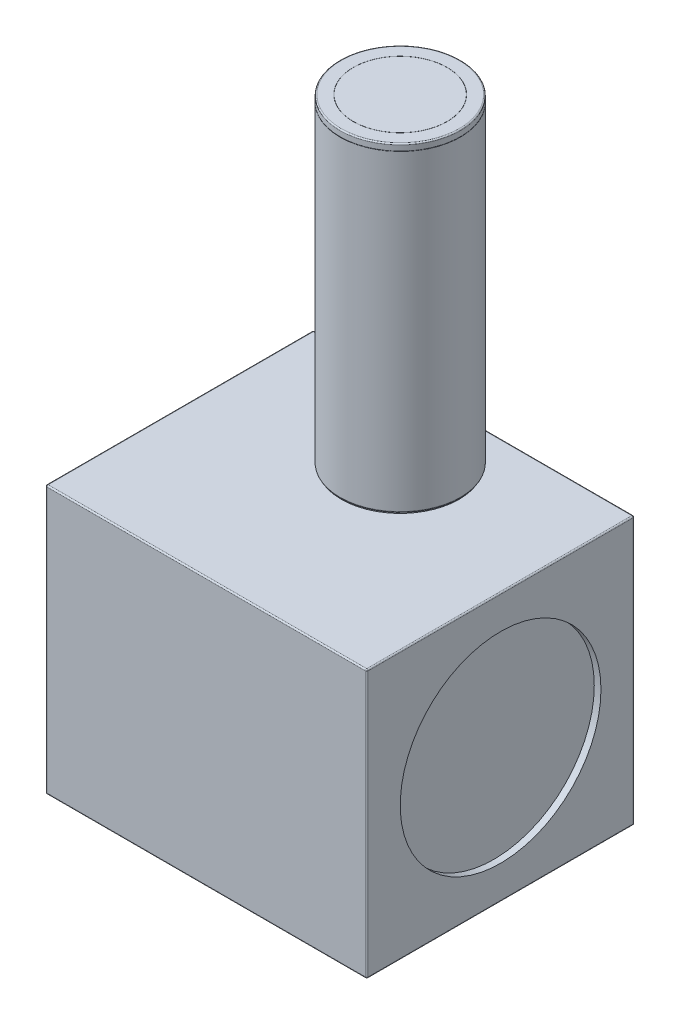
SolidWorks part; units mm, degrees
ref_plane "Front Plane" through (0, 0, 0) normal (0, 0, 1) x (1, 0, 0)
ref_plane "Top Plane" through (0, 0, 0) normal (0, 1, 0) x (1, 0, 0)
ref_plane "Right Plane" through (0, 0, 0) normal (1, 0, 0) x (0, 0, -1)
sketch "Sketch1" plane through (0, 0, 0) normal (0, 0, 1) x (1, 0, 0)
  line L1 (-12, 10) -> (12, 10)
  line L2 (-12, 10) -> (-12, -10)
  line L3 (-12, -10) -> (12, -10)
  line L4 (12, 10) -> (12, -10)
  dimension "D1" = 24
  dimension "D2" = 12
  dimension "D3" = 10
  dimension "D4" = 20
extrude "Boss-Extrude1" add sketch "Sketch1" along normal blind 20
sketch "Sketch2" plane through (12, 0, 0) normal (1, 0, 0) x (0, 0, -1)
  line L0 (-10, 10) -> (-10, -10) construction
  line L1 (-20, 10) -> (0, 10) construction
  line L2 (-20, -10) -> (0, -10) construction
  line L3 (0, 0) -> (-20, 0) construction
  line L4 (-20, -10) -> (-20, 10) construction
  circle A0 centre (-10, 0) radius 7.5
  dimension "D1" = 15
extrude "Cut-Extrude1" cut sketch "Sketch2" against normal blind 0.5
sketch "Sketch3" plane through (-12, 0, 0) normal (-1, 0, 0) x (0, 0, 1)
  line L0 (10, 10) -> (10, -10) construction
  line L1 (20, 10) -> (0, 10) construction
  line L2 (20, -10) -> (0, -10) construction
  line L4 (20, 10) -> (20, -10) construction
  line L5 (20, 0) -> (0, 0) construction
  circle A0 centre (10, 0) radius 7.5
  dimension "D1" = 15
extrude "Cut-Extrude2" cut sketch "Sketch3" against normal blind 0.5
sketch "Sketch4" plane through (0, 0, 0) normal (1, 0, 0) x (0, 0, -1)
  line L0 (-5.5, 34) -> (-5.5, -16) construction
  line L1 (0, -10) -> (0, 10) construction
  line L3 (-5.5, -16) -> (-9.91, -16)
  line L4 (-10, -15.91) -> (-10, -10.19)
  line L5 (-9.91, -10.1) -> (-9.9, -10.1)
  line L6 (-9.9, -10.1) -> (-9.9, -10)
  line L7 (-20, -10) -> (0, -10) construction
  line L8 (-9.9, 10) -> (-9.9, 10.1)
  line L9 (-20, 10) -> (0, 10) construction
  line L10 (-9.9, 10.1) -> (-9.91, 10.1)
  line L11 (-10, 10.19) -> (-10, 33.491)
  line L12 (-9.91, 34) -> (-9.01, 34)
  line L13 (-9.991, 33.51) -> (-9.99, 33.51)
  line L15 (-9.99, 33.51) -> (-9.99, 33.5)
  line L16 (-9.99, 33.5) -> (-9.991, 33.5)
  line L17 (-10, 33.519) -> (-10, 33.91)
  line L18 (-9.01, 34) -> (-9.01, 33.9)
  line L19 (-9.01, 33.9) -> (-9, 33.9)
  line L20 (-9, 33.9) -> (-9, 34)
  line L21 (-9.9, 10) -> (-9.9, -10)
  line L22 (-9, 34) -> (-5.5, 34)
  line L23 (-5.5, 34) -> (-5.5, -16)
  arc A0 (-9.91, -16) -> (-10, -15.91) centre (-9.91, -15.91) cw
  arc A1 (-10, -10.19) -> (-9.91, -10.1) centre (-9.91, -10.19) cw
  arc A2 (-10, 33.491) -> (-9.991, 33.5) centre (-9.991, 33.491) cw
  arc A3 (-10, 33.519) -> (-9.991, 33.51) centre (-9.991, 33.519) ccw
  arc A4 (-9.91, 10.1) -> (-10, 10.19) centre (-9.91, 10.19) cw
  arc A5 (-10, 33.91) -> (-9.91, 34) centre (-9.91, 33.91) cw
  point P12 (-10, -16)
  point P29 (-10, 33.51)
  point P34 (-10, 34)
  dimension "D15" = 0.01
  dimension "D18" = 50
  dimension "D6" = 0.09
  dimension "D12" = 0.009
  dimension "D13" = 0.09
  dimension "D1" = 5.5
  dimension "D2" = 4.5
  dimension "D3" = 0.1
  dimension "D4" = 0.1
  dimension "D5" = 6
  dimension "D7" = 4.5
  dimension "D9" = 0.01
  dimension "D10" = 0.01
  dimension "D11" = 0.49
  dimension "D14" = 0.1
  dimension "D16" = 0.1
  dimension "D17" = 1
revolve "Revolve1" add sketch "Sketch4" angle 360 about L0
sketch "Sketch5" plane through (0, -16, 0) normal (0, -1, 0) x (1, 0, 0)
  line L1 (0, 8.0981) -> (-2.25, 6.799)
  line L2 (-2.25, 6.799) -> (-2.25, 4.201)
  line L3 (-2.25, 4.201) -> (0, 2.9019)
  line L4 (0, 2.9019) -> (2.25, 4.201)
  line L5 (2.25, 4.201) -> (2.25, 6.799)
  line L6 (2.25, 6.799) -> (0, 8.0981)
  circle A0 centre (0, 5.5) radius 2.25 construction
  dimension "D1" = 4.5
extrude "Cut-Extrude3" cut sketch "Sketch5" against normal blind 4
fillet "Fillet1" radius 0.1 12 edges at (0, -10, 0) (12, 0, 0) (0, 10, 0) (-12, 0, 0) (0, 10, 20) (12, 0, 20) (0, -10, 20) (-12, 0, 20) (-12, -10, 10) (-12, 10, 10) (12, 10, 10) (12, -10, 10)
